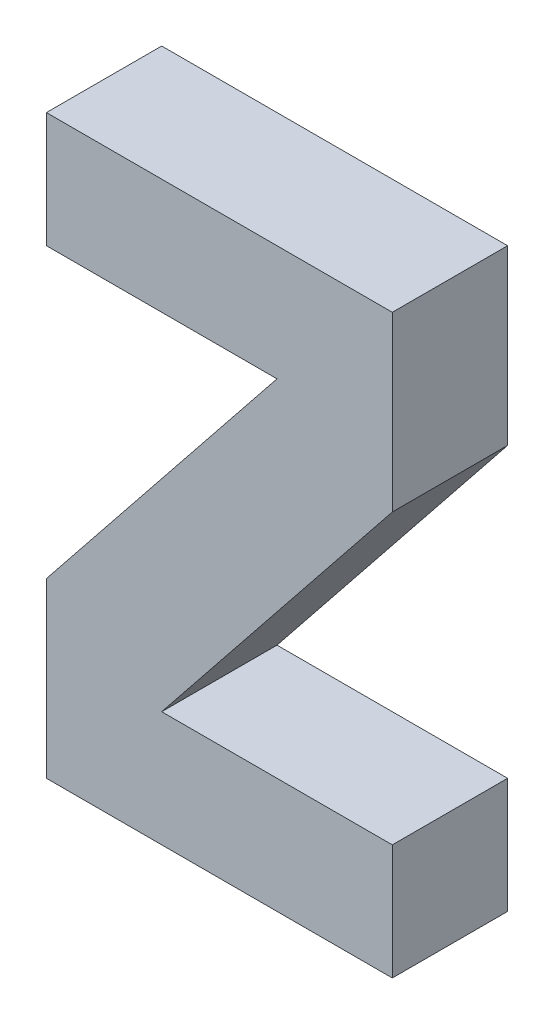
SolidWorks part; units mm, degrees
ref_plane "Plan de face" through (0, 0, 0) normal (0, 0, 1) x (1, 0, 0)
ref_plane "Plan de dessus" through (0, 0, 0) normal (0, 1, 0) x (1, 0, 0)
ref_plane "Plan de droite" through (0, 0, 0) normal (1, 0, 0) x (0, 0, -1)
sketch "Esquisse1" plane through (0, 0, 0) normal (0, 0, 1) x (1, 0, 0)
  line L0 (0, 40) -> (20, 40)
  line L1 (0, 0) -> (30, 0)
  line L2 (0, 0) -> (0, 15)
  line L3 (0, 50) -> (30, 50)
  line L4 (30, 0) -> (30, 10)
  line L5 (20, 40) -> (0, 15)
  line L6 (30, 10) -> (10, 10)
  line L7 (10, 10) -> (30, 35)
  line L8 (0, 40) -> (0, 50)
  line L9 (30, 35) -> (30, 50)
  dimension "D1" = 30
  dimension "D2" = 50
  dimension "D3" = 10
  dimension "D4" = 10
  dimension "D5" = 15
  dimension "D6" = 15
  dimension "D7" = 20
extrude "Boss.-Extru.1" add sketch "Esquisse1" along normal blind 10
